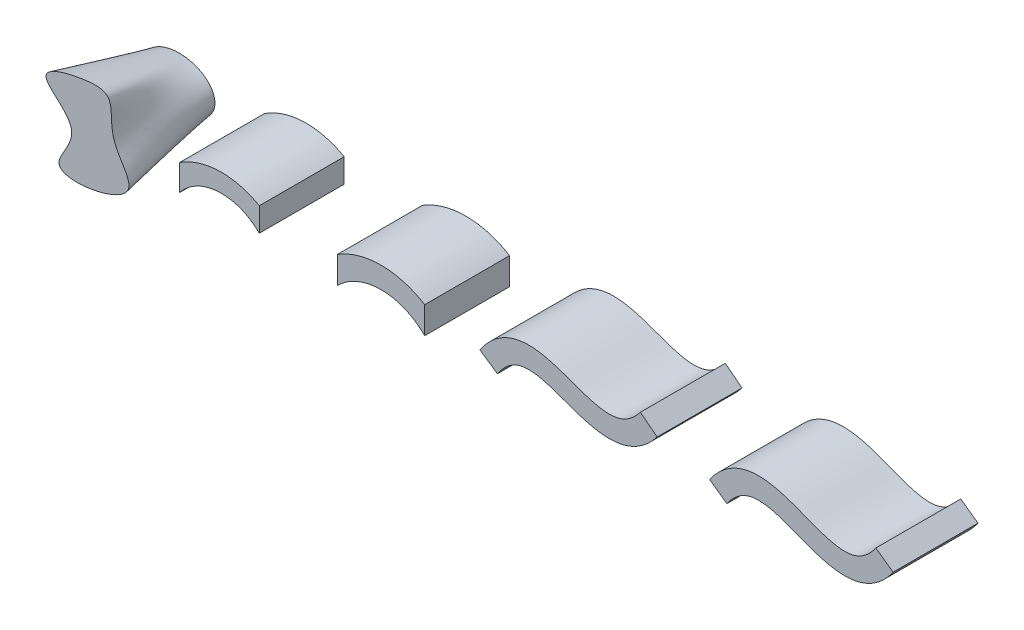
SolidWorks part; units mm, degrees
ref_plane "Front Plane" through (0, 0, 0) normal (0, 0, 1) x (1, 0, 0)
ref_plane "Top Plane" through (0, 0, 0) normal (0, 1, 0) x (1, 0, 0)
ref_plane "Right Plane" through (0, 0, 0) normal (1, 0, 0) x (0, 0, -1)
sketch "Sketch4" plane through (0, 0, 0) normal (0, 0, 1) x (1, 0, 0)
  line L3 (114.5814, -5.5048) -> (114.5814, 7.1643)
  line L4 (155.6565, -5.5048) -> (155.6565, 7.1643)
  line L9 (40.0777, -4.8954) -> (40.0777, 7.3477)
  line L10 (77.7037, -2.6677) -> (77.7037, 8.5702)
  arc A0 (114.5814, 7.1643) -> (155.6565, 7.1643) centre (135.1189, -26.0424) cw
  arc A1 (114.5814, -5.5048) -> (155.6565, -5.5048) centre (135.1189, -26.0424) cw
  arc A2 (107.5103, 1.5663) -> (162.7276, 1.5663) centre (135.1189, -26.0424) cw construction
  circle A3 centre (135.1189, -26.0424) radius 29.0445 construction
  circle A4 centre (135.1189, -26.0424) radius 39.0445 construction
  arc A5 (40.0777, -4.8954) -> (77.7037, -2.6677) centre (59.8801, -20.4913) cw
  arc A6 (40.0777, 7.3477) -> (77.7037, 8.5702) centre (59.8801, -22.4913) cw
  circle A7 centre (59.8801, -20.4913) radius 25.2065 construction
  circle A8 centre (59.8801, -22.4913) radius 35.8121 construction
  dimension "D1" = 10
  dimension "D2" = 2
extrude "Boss-Extrude3" add sketch "Sketch4" along normal blind 40 separate body
ref_plane "Plane2" through (0, 0, 40) normal (0, 0, 1) x (1, 0, 0)
sketch "Sketch2" plane through (0, 0, 0) normal (0, 0, 1) x (1, 0, 0)
  circle A0 centre (0, 0) radius 16.8083 construction
  ellipse E0 centre (0, 0) end of major axis (-16.8083, 0) minor radius 12.0019
sketch "Sketch12" plane through (0, 0, 40) normal (0, 0, 1) x (1, 0, 0)
  spline S0 degree 3 poles (10.1106, 20.0032) (-7.8767, 18.9867) (-32.9107, 12.0407) (-1.8742, -2.9805) (-30.6883, -30.8807) (29.5125, -21.0381) (5.4284, -0.1951) (10.1106, 20.0032) (-7.8767, 18.9867) (-32.9107, 12.0407) knots -0.343083 -0.203088 -0.087868 0 0.136656 0.285215 0.412827 0.656917 0.796912 0.912132 1 1.136656 1.285215 1.412827 only from (-5.7805, 18.5953) to (-5.7805, 18.5953)
  point P2 (-15.3771, 0)
  point P4 (-35.7809, -12.3537)
  point P6 (10.6499, 5.6402)
  point P8 (-14.2524, 23.1522)
  point P10 (23.6634, -10.4258)
  point P12 (-22.9281, 3.8729)
  point P13 (-3.9702, -27.1345)
  point P14 (-37.7088, 15.7618)
  point P15 (-29.0332, -10.4258)
  point P16 (-31.1218, -11.8718)
  point P17 (-20.9808, -9.4095)
  point P18 (22.2317, 11.0944)
  point P19 (-24.9493, 26.8581)
  point P20 (0, -25.7245)
  point P21 (-17.4185, 10.6149)
  point P22 (16.7197, -10.7769)
  point P23 (14.0596, 21.6988)
  point P24 (-5.7805, 18.5953)
  point P25 (10.6983, 5.58)
  point P26 (-22.796, 11.0989)
  point P27 (6.1309, 17.5694)
  point P28 (13.1723, -10.2156)
  point P29 (8.9855, 2.1544)
  point P30 (16.027, -15.5442)
  point P31 (-10.7333, -5.1205)
  point P32 (-16.6564, -21.4421)
loft "Loft1" add profiles "Sketch2", "Sketch12"
sketch "Sketch9" plane through (0, 0, 0) normal (0, 0, 1) x (1, 0, 0)
  line L0 (184.6907, -0.3268) -> (186.8976, -1.8336) construction
  line L1 (251.9049, 17.402) -> (270.6039, 4.6351) construction
  spline S0 degree 3 poles (185.7942, -1.0802) (207.7796, 31.1205) (237.961, -19.0034) (261.2544, 11.0186) knots 0 0 0 0 1 1 1 1
  point P2 (259.0573, 7.5312)
  point P4 (235.8518, 2.3531)
  point P10 (206.6757, 10.1223)
  point P11 (185.7942, -1.0802)
  point P12 (261.2544, 11.0186)
  point P13 (238.8493, 1.25)
extrude "Extrude-Thin3" add sketch "Sketch9" along normal blind 40 separate body thin contours S0
sketch "Sketch11" plane through (0, 0, 0) normal (0, 0, 1) x (1, 0, 0)
  line L0 (287.9448, 4.3481) -> (300.0244, -4.2413) construction
  line L1 (359.8555, 20.1325) -> (384.7905, 2.4019) construction
  spline S0 degree 3 poles (293.9846, 0.0534) (317.1377, 32.6141) (349.3855, -20.9902) (372.323, 11.2672) knots 0 0 0 0 1 1 1 1
surface "Surface-Extrude1" sketch "Sketch11" parameters "D1"=40
thicken "Thicken1" surfaces to thicken 165 thickness 5 thickness side both sides parameters "D1"=5
